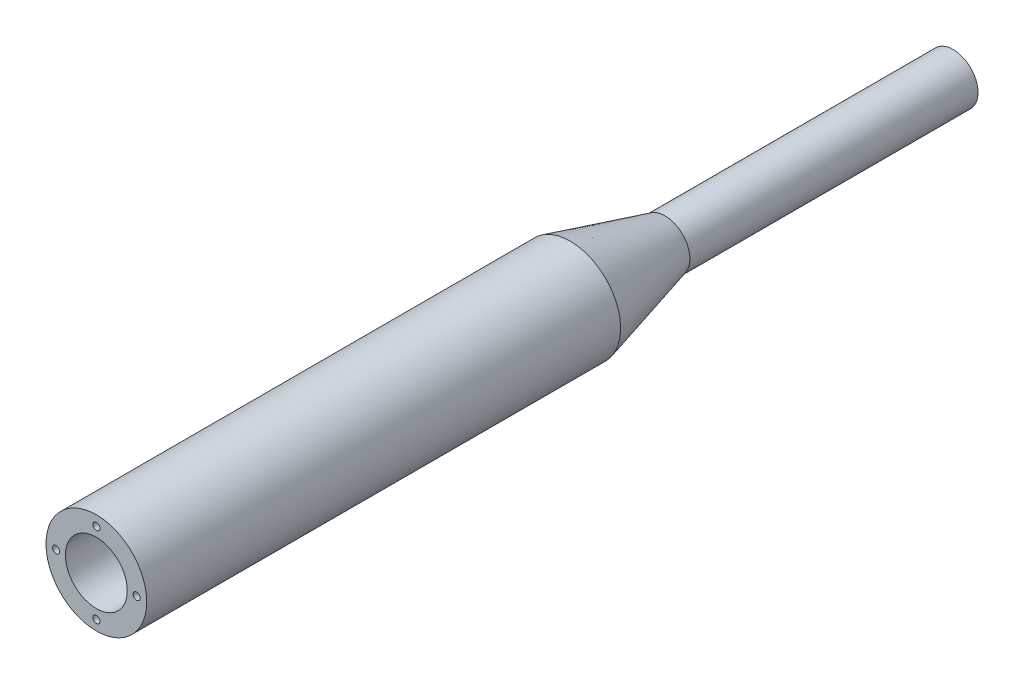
SolidWorks part; units mm, degrees
ref_plane "Front Plane" through (0, 0, 0) normal (0, 0, 1) x (1, 0, 0)
ref_plane "Top Plane" through (0, 0, 0) normal (0, 1, 0) x (1, 0, 0)
ref_plane "Right Plane" through (0, 0, 0) normal (1, 0, 0) x (0, 0, -1)
sketch "Sketch1" plane through (0, 0, 0) normal (0, 0, 1) x (1, 0, 0)
  circle A0 centre (0, 0) radius 26.9875
  dimension "D1" = 53.975
extrude "Boss-Extrude1" add sketch "Sketch1" along normal blind 254
sketch "Sketch2" plane through (0, 0, 0) normal (0, 0, -1) x (-1, 0, 0)
  circle A0 centre (0, 0) radius 6.35
  circle A1 centre (0, 0) radius 13.335
  dimension "D1" = 26.67
  dimension "D2" = 12.7
extrude "Boss-Extrude2" add sketch "Sketch2" along normal blind 205.232 separate body
sketch "Sketch4" plane through (0, 0, 0) normal (1, 0, 0) x (0, 0, -1)
  line L0 (0, 26.9875) -> (0, 13.335)
  line L1 (0, 26.9875) -> (50.8, 13.335)
  line L2 (205.232, 13.335) -> (0, 13.335) construction
  line L3 (0, 13.335) -> (50.8, 13.335)
  dimension "D1" = 50.8
ref_axis "Axis1" through (0, 0, -205.232) along (0, 0, 1)
revolve "Revolve1" add sketch "Sketch4" angle 360 about axis through (0, 0, -205.232) along (0, 0, 1)
hole_wizard "1 (1) Diameter Hole1" positions "Sketch6" profile "Sketch7" hole size "1" standard "ANSI Inch"
sketch "Sketch6" plane through (0, 0, 254) normal (0, 0, 1) x (1, 0, 0)
  point P0 (0, 0)
sketch "Sketch7" plane through (0, 0, 254) normal (1, 0, 0) x (0, -1, 0)
  line L0 (0, 0) -> (0, 263.5387)
  line L1 (0, 263.5387) -> (15.875, 254)
  line L2 (15.875, 254) -> (15.875, 0)
  line L5 (15.875, 0) -> (0, 0)
  line L10 (0, 263.5387) -> (-15.875, 254) construction
  line L11 (0, -6.35) -> (0, 107.95) construction
  dimension "Hole Dia." = 31.75
  dimension "Hole Depth" = 254
  dimension "Drill Angle" = 118
sketch "Sketch8" plane through (0, 0, 254) normal (0, 0, 1) x (1, 0, 0)
  circle A0 centre (0, 0) radius 16.5735
  dimension "D1" = 33.147
extrude "Cut-Extrude1" cut sketch "Sketch8" against normal blind 25.4
hole_wizard "#10-24 Tapped Hole1" positions "Sketch11" profile "Sketch9" tap size "#10-24" standard "ANSI Inch"
sketch "Sketch11" plane through (0, 0, 254) normal (0, 0, 1) x (1, 0, 0)
  circle A0 centre (0, 0) radius 21.59
  point P0 (0, 21.59)
  point P2 (-21.59, 0)
  point P4 (0, -21.59)
  point P6 (21.59, 0)
  dimension "D1" = 43.18
sketch "Sketch9" plane through (0, 21.59, 254) normal (1, 0, 0) x (0, -1, 0)
  line L0 (0, 0) -> (0, 26.5408)
  line L1 (0, 26.5408) -> (1.8986, 25.4)
  line L2 (1.8986, 25.4) -> (1.8986, 0)
  line L5 (1.8986, 0) -> (0, 0)
  line L10 (0, 26.5408) -> (-1.8987, 25.4) construction
  line L11 (0, -6.35) -> (0, 107.95) construction
  dimension "Tap Drill Dia." = 3.7973
  dimension "Tap Drill Depth" = 25.4
  dimension "Drill Angle" = 118
